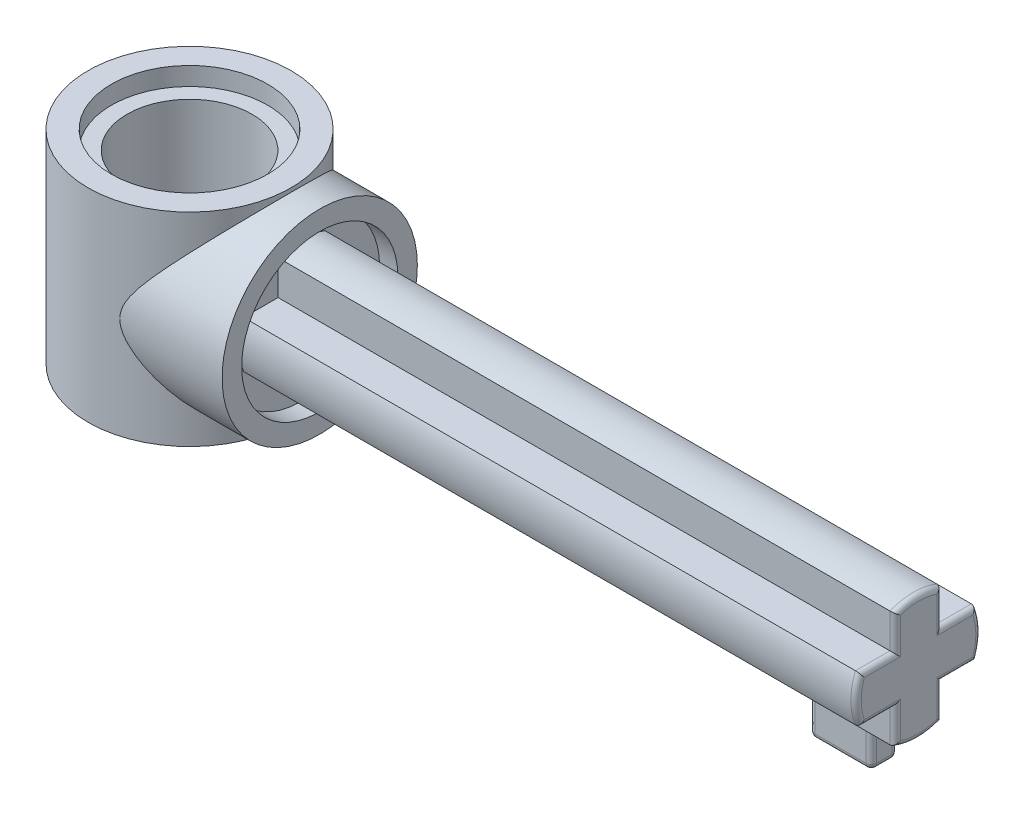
SolidWorks part; units mm, degrees
ref_plane "Front Plane" through (0, 0, 0) normal (0, 0, 1) x (1, 0, 0)
ref_plane "Top Plane" through (0, 0, 0) normal (0, 1, 0) x (1, 0, 0)
ref_plane "Right Plane" through (0, 0, 0) normal (1, 0, 0) x (0, 0, -1)
sketch "Sketch1" plane through (0, 0, 0) normal (0, 1, 0) x (1, 0, 0)
  circle A0 centre (0, 0) radius 3.9
  dimension "D1" = 7.8
extrude "Boss-Extrude1" add sketch "Sketch1" along normal blind 7.8
sketch "Sketch2" plane through (0, 7.8, 0) normal (0, 1, 0) x (1, 0, 0)
  circle A0 centre (0, 0) radius 3
  dimension "D1" = 6
extrude "Cut-Extrude1" cut sketch "Sketch2" against normal blind 0.7
sketch "Sketch3" plane through (0, 0, 0) normal (0, -1, 0) x (1, 0, 0)
  circle A0 centre (0, 0) radius 3
  dimension "D1" = 6
extrude "Cut-Extrude2" cut sketch "Sketch3" against normal blind 0.7
sketch "Sketch4" plane through (0, 0, 0) normal (0, -1, 0) x (1, 0, 0)
  circle A0 centre (0, 0) radius 2.4
  dimension "D1" = 4.8
extrude "Cut-Extrude3" cut sketch "Sketch4" against normal through all
ref_plane "Plane1" through (5, 0, 0) normal (1, 0, 0) x (0, 0, -1)
sketch "Sketch6" plane through (5, 0, 0) normal (1, 0, 0) x (0, 0, -1)
  line L0 (-3.9, 0) -> (3.9, 0) construction
  circle A0 centre (0, 3.9) radius 3.75
  dimension "D1" = 7.5
  dimension "D2" = 3.9
extrude "Boss-Extrude2" add sketch "Sketch6" against normal up to surface (3.9288 mm away)
sketch "Sketch10" plane through (5, 0, 0) normal (1, 0, 0) x (0, 0, -1)
  circle A0 centre (0, 3.9) radius 3
  circle A1 centre (0, 3.9) radius 3.75 construction
  dimension "D1" = 6
extrude "Cut-Extrude7" cut sketch "Sketch10" against normal blind 0.7
ref_plane "Plane2" through (28, 0, 0) normal (1, 0, 0) x (0, 0, -1)
sketch "Sketch12" plane through (28, 0, 0) normal (1, 0, 0) x (0, 0, -1)
  line L0 (-4.7109, 3.9) -> (5.9815, 3.9) construction
  line L1 (0, 8.5779) -> (0, -1.867) construction
  line L2 (-2.2249, 4.8) -> (-0.9, 4.8)
  line L3 (-2.2249, 3) -> (-0.9, 3)
  line L4 (-0.9, 6.1249) -> (-0.9, 4.8)
  line L5 (0.9, 6.1249) -> (0.9, 4.8)
  line L6 (-0.9, 3) -> (-0.9, 1.6751)
  line L7 (0.9, 3) -> (0.9, 1.6751)
  line L8 (0.9, 4.8) -> (2.2249, 4.8)
  line L9 (0.9, 3) -> (2.2249, 3)
  arc A0 (-2.2249, 4.8) -> (-2.2249, 3) centre (0, 3.9) ccw
  arc A1 (0.9, 6.1249) -> (-0.9, 6.1249) centre (0, 3.9) ccw
  arc A2 (2.2249, 3) -> (2.2249, 4.8) centre (0, 3.9) ccw
  arc A3 (-0.9, 1.6751) -> (0.9, 1.6751) centre (0, 3.9) ccw
  dimension "D1" = 4.8
  dimension "D2" = 0.9
  dimension "D3" = 1.8
  dimension "D4" = 0.9
  dimension "D5" = 1.8
extrude "Boss-Extrude3" add sketch "Sketch12" against normal up to surface (23.7 mm away)
fillet "Fillet1" radius 0.2 12 edges at (28, 6.3, 0) (28, 5.4624, -0.9) (28, 4.8, -1.5624) (28, 3.9, -2.4) (28, 3, -1.5624) (28, 2.3376, -0.9) (28, 1.5, 0) (28, 2.3376, 0.9) (28, 3, 1.5624) (28, 3.9, 2.4) (28, 4.8, 1.5624) (28, 5.4624, 0.9)
sketch "Sketch13" plane through (0, 0, 0) normal (0, 1, 0) x (1, 0, 0)
  line L0 (4.3, 0.9) -> (27.8, 0.9) construction
  line L1 (26.6851, -0.5) -> (24.3149, -0.5)
  line L2 (26.6851, -0.5) -> (26.6851, 0.5)
  line L3 (26.6851, 0.5) -> (24.3149, 0.5)
  line L4 (24.3149, -0.5) -> (24.3149, 0.5)
  line L5 (26.6851, -0.5) -> (24.3149, 0.5) construction
  line L6 (26.6851, 0.5) -> (24.3149, -0.5) construction
  line L7 (28, -0.7) -> (28, 0.7) construction
  point P0 (25.5, 0)
  dimension "D1" = 1
  dimension "D2" = 0.4
  dimension "D3" = 2.5
extrude "Boss-Extrude4" add sketch "Sketch13" along normal up to surface (1.5527 mm away)
fillet "Fillet2" radius 0.2 12 edges at (25.5, 1.5527, 0.5) (25.5, 1.5527, -0.5) (25.5, 0, 0.5) (25.5, 0, -0.5) (24.3149, 0, 0) (24.3149, 0.7763, -0.5) (24.3149, 1.5, 0) (24.3149, 0.7763, 0.5) (26.6851, 0, 0) (26.6851, 0.7763, 0.5) (26.6851, 1.5, 0) (26.6851, 0.7763, -0.5)
